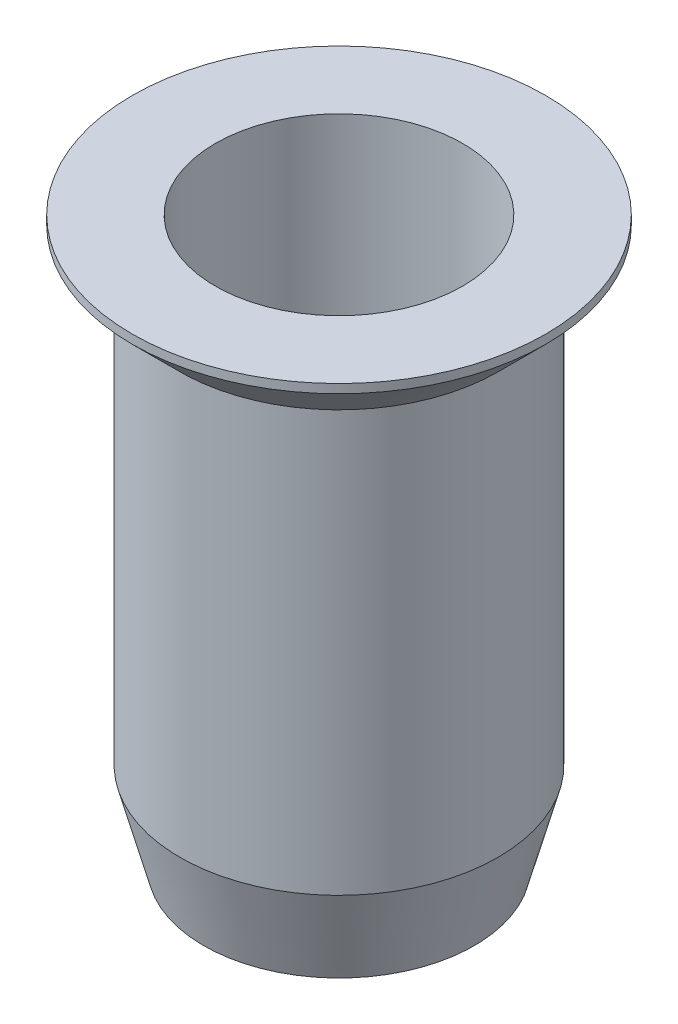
SolidWorks part; units mm, degrees
ref_plane "Plan de face" through (0, 0, 0) normal (0, 0, 1) x (1, 0, 0)
ref_plane "Plan de dessus" through (0, 0, 0) normal (0, 1, 0) x (1, 0, 0)
ref_plane "Plan de droite" through (0, 0, 0) normal (1, 0, 0) x (0, 0, -1)
sketch "Esquisse1" plane through (0, 0, 0) normal (0, 0, 1) x (1, 0, 0)
  line L0 (0, 0) -> (0, -16) construction
  line L1 (3.5, 0) -> (5.85, 0)
  line L2 (5.85, 0) -> (5.85, -0.25)
  line L3 (4.5, -1.6) -> (4.5, -13.5)
  line L4 (4.5, -13.5) -> (3.8301, -16)
  line L5 (3.8301, -16) -> (3, -16)
  line L6 (3, -16) -> (3, -7.2887)
  line L7 (3, -7.2887) -> (3.5, -7)
  line L8 (3.5, -7) -> (3.5, 0)
  line L9 (5.85, -0.25) -> (4.5, -1.6)
  dimension "d1" = 6
  dimension "D2" = 60
  dimension "B" = 11.7
  dimension "D" = 9
  dimension "D6" = 45
  dimension "E" = 1.6
  dimension "L" = 16
  dimension "D10" = 15
  dimension "D11" = 2.5
revolve "Révolution1" add sketch "Esquisse1" angle 360 about L0
equation "\"L1@Esquisse1\" = \"d1@Esquisse1\"+1"
